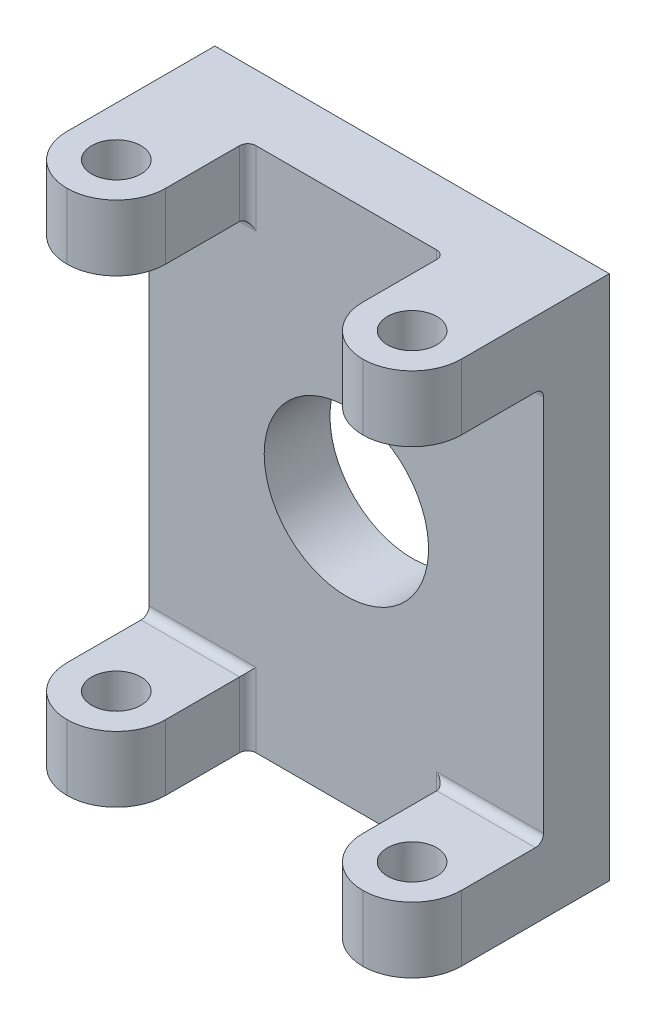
SolidWorks part; units mm, degrees
ref_plane "Front Plane" through (0, 0, 0) normal (0, 0, 1) x (1, 0, 0)
ref_plane "Top Plane" through (0, 0, 0) normal (0, 1, 0) x (1, 0, 0)
ref_plane "Right Plane" through (0, 0, 0) normal (1, 0, 0) x (0, 0, -1)
sketch "Sketch2" plane through (0, 0, 0) normal (0, 0, 1) x (1, 0, 0)
  line L0 (0, 0) -> (137.829, 0) construction
  line L1 (0, 0) -> (0, 93.6852) construction
  line L3 (-76.2, -101.6) -> (76.2, -101.6)
  line L4 (-76.2, -101.6) -> (-76.2, 101.6)
  line L5 (-76.2, 101.6) -> (76.2, 101.6)
  line L6 (76.2, -101.6) -> (76.2, 101.6)
  dimension "D1" = 152.4
  dimension "D2" = 203.2
  dimension "D3" = 76.2
  dimension "D4" = 101.6
extrude "Extrude2" add sketch "Sketch2" along normal blind 25.4
sketch "Sketch6" plane through (0, 0, 0) normal (0, 0, -1) x (-1, 0, 0)
  circle A0 centre (0, 0) radius 31.75
  dimension "D1" = 63.5
extrude "Cut-Extrude2" cut sketch "Sketch6" against normal through all
sketch "Sketch3" plane through (0, 0, 25.4) normal (0, 0, 1) x (1, 0, 0)
  line L1 (-76.2, -101.6) -> (-38.1, -101.6)
  line L2 (-76.2, -101.6) -> (-76.2, -76.2)
  line L3 (-76.2, -76.2) -> (-38.1, -76.2)
  line L4 (-38.1, -101.6) -> (-38.1, -76.2)
  dimension "D1" = 38.1
  dimension "D2" = 25.4
extrude "Extrude3" add sketch "Sketch3" along normal blind 50.8
fillet "Fillet1" radius 19.05 2 edges at (-38.1, -88.9, 76.2) (-76.2, -88.9, 76.2)
sketch "Sketch4" plane through (0, -101.6, 0) normal (0, -1, 0) x (1, 0, 0)
  circle A0 centre (-57.15, 57.15) radius 9.525
  arc A1 (-57.15, 76.2) -> (-76.2, 57.15) centre (-57.15, 57.15) ccw construction
  dimension "D1" = 19.05
extrude "Cut-Extrude1" cut sketch "Sketch4" against normal through all
mirror "Mirror1" about plane through (0, 0, 0) normal (1, 0, 0) of "Cut-Extrude1", "Fillet1", "Extrude3"
mirror "Mirror2" about plane through (0, 0, 0) normal (0, 1, 0) of "Mirror1", "Cut-Extrude1", "Fillet1", "Extrude3"
fillet "Fillet2" radius 3.175 8 edges at (38.1, -88.9, 25.4) (38.1, 88.9, 25.4) (-38.1, 88.9, 25.4) (57.15, -76.2, 25.4) (-57.15, 76.2, 25.4) (57.15, 76.2, 25.4)
equation "\"D3@Sketch2\" = \"D1@Sketch2\"/2"
